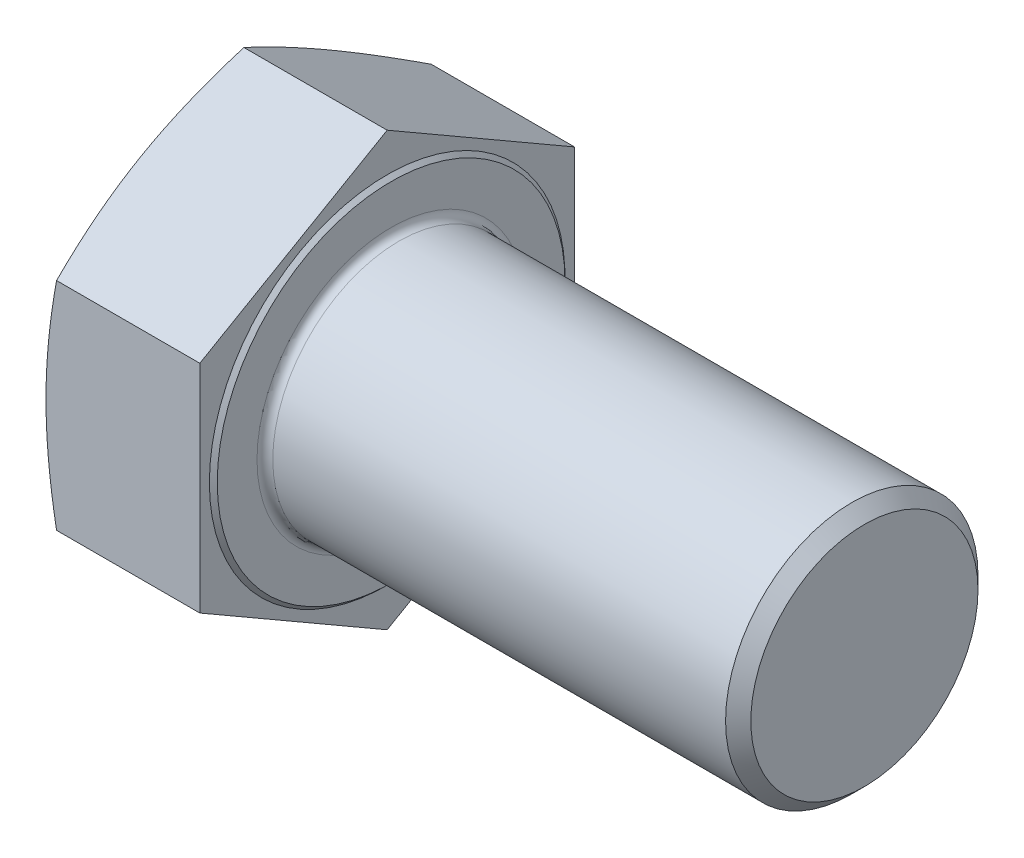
SolidWorks part; units mm, degrees
ref_plane "Front" through (0, 0, 0) normal (0, 0, 1) x (1, 0, 0)
ref_plane "Top" through (0, 0, 0) normal (0, 1, 0) x (1, 0, 0)
ref_plane "Right" through (0, 0, 0) normal (1, 0, 0) x (0, 0, -1)
sketch "Sketch2" plane through (0, 0, 0) normal (1, 0, 0) x (0, 0, -1)
  line L1 (0, -54.8483) -> (47.5, -27.4241)
  line L2 (47.5, -27.4241) -> (47.5, 27.4241)
  line L3 (47.5, 27.4241) -> (0, 54.8483)
  line L4 (0, 54.8483) -> (-47.5, 27.4241)
  line L5 (-47.5, 27.4241) -> (-47.5, -27.4241)
  line L6 (-47.5, -27.4241) -> (0, -54.8483)
  circle A0 centre (0, 0) radius 47.5 construction
  dimension "s" = 95
extrude "BaseHead" add sketch "Sketch2" along normal blind 40
sketch "Sketch3" plane through (0, 0, 0) normal (0, 0, 1) x (1, 0, 0)
  line L0 (40, 54.8483) -> (40, 44.08)
  line L2 (40, 44.08) -> (39, 45.08)
  line L3 (39, 45.08) -> (39, 54.8483)
  line L5 (39, 54.8483) -> (40, 54.8483)
  line L6 (-0.9571, 0) -> (7.6478, 0) construction
  line L7 (40, 54.8483) -> (0, 54.8483) construction
  dimension "D1" = 45
  dimension "c" = 1
  dimension "dw" = 88.16
revolve "BearingFace" cut sketch "Sketch3" angle 360 about L6
sketch "Sketch4" plane through (0, 0, 0) normal (0, 0, 1) x (1, 0, 0)
  line L0 (-0.4935, 0) -> (3.5626, 0) construction
  line L2 (0, 54.8483) -> (2.6746, 54.8483)
  line L4 (2.6746, 54.8483) -> (0, 47.5)
  line L6 (0, 47.5) -> (0, 54.8483)
  line L7 (39, 54.8483) -> (0, 54.8483) construction
  dimension "D1" = 20
  dimension "D2" = 95
revolve "HeadChamfer" cut sketch "Sketch4" angle 360 about L0
sketch "Sketch5" plane through (40, 0, 0) normal (1, 0, 0) x (0, 0, -1)
  circle A0 centre (0, 0) radius 32
  dimension "d" = 64
extrude "BaseBody" add sketch "Sketch5" along normal blind 120
chamfer "Chamfer1" distance 3.2 angle 45 1 edges at (160, 0, -32)
fillet "HeadFillet" radius 2 1 edges at (40, 0, -32)
equation "\"D2@Sketch4\" = \"s@Sketch2\""
equation "\"D1@Chamfer1\" = 0.05 * \"d@Sketch5\""
